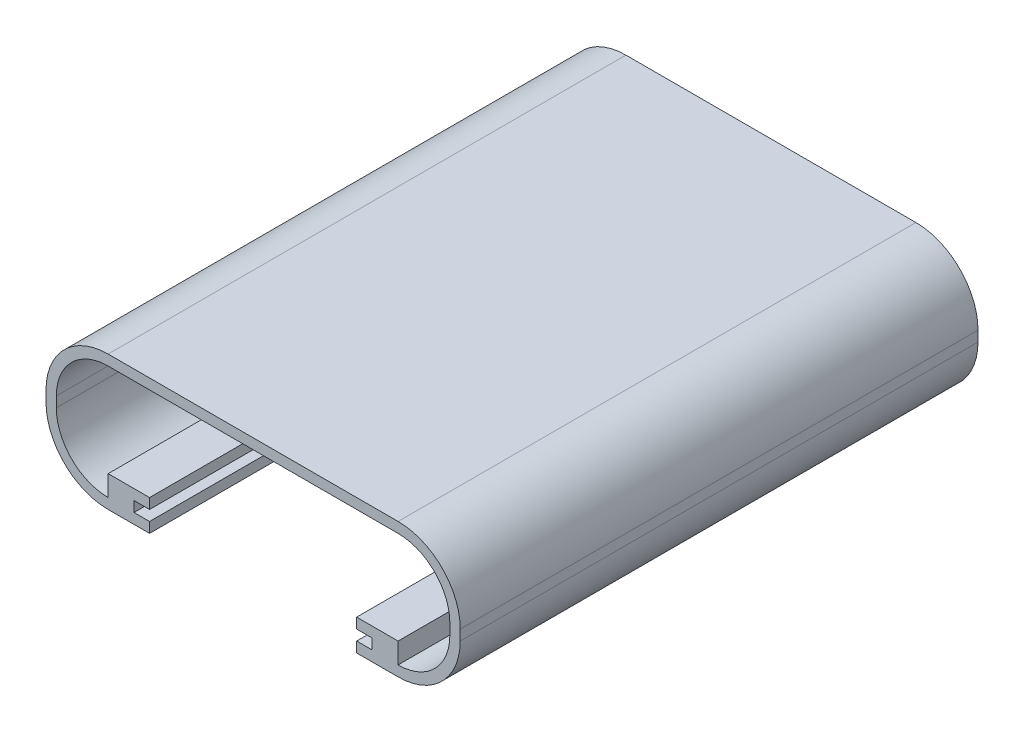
SolidWorks part; units mm, degrees
ref_plane "Plan de face" through (0, 0, 0) normal (0, 0, 1) x (1, 0, 0)
ref_plane "Plan de dessus" through (0, 0, 0) normal (0, 1, 0) x (1, 0, 0)
ref_plane "Plan de droite" through (0, 0, 0) normal (1, 0, 0) x (0, 0, -1)
sketch "Esquisse1" plane through (0, 0, 0) normal (0, 0, 1) x (1, 0, 0)
  line L0 (-21.316, 1) -> (-21.316, 0)
  line L1 (1.684, 0) -> (0.184, 0)
  line L2 (-19.816, 0) -> (-19.816, -1)
  line L3 (-28.816, 5) -> (-28.816, 6)
  line L4 (-21.316, 0) -> (-19.816, 0)
  line L5 (9.184, 5) -> (9.184, 6)
  line L6 (4.184, 0) -> (4.184, 2)
  line L7 (-23.816, 11) -> (4.184, 11)
  line L8 (4.184, 2) -> (0.184, 2)
  line L9 (0.184, 2) -> (0.184, 1)
  line L10 (0.184, 0) -> (0.184, -1)
  line L11 (0.184, -1) -> (4.184, -1)
  line L12 (-19.816, -1) -> (-23.816, -1)
  line L13 (10.184, 5) -> (10.184, 6)
  line L14 (-29.816, 5) -> (-29.816, 6)
  line L15 (0.184, 1) -> (1.684, 1)
  line L16 (-23.816, 12) -> (4.184, 12)
  line L17 (-23.816, 0) -> (-23.816, 2)
  line L18 (-23.816, 2) -> (-19.816, 2)
  line L19 (-19.816, 2) -> (-19.816, 1)
  line L20 (-19.816, 1) -> (-21.316, 1)
  line L21 (1.684, 1) -> (1.684, 0)
  arc A0 (-23.816, 0) -> (-28.816, 5) centre (-23.816, 5) cw
  arc A1 (4.184, 0) -> (9.184, 5) centre (4.184, 5) ccw
  arc A2 (-28.816, 6) -> (-23.816, 11) centre (-23.816, 6) cw
  arc A3 (9.184, 6) -> (4.184, 11) centre (4.184, 6) ccw
  arc A4 (4.184, -1) -> (10.184, 5) centre (4.184, 5) ccw
  arc A5 (-29.816, 6) -> (-23.816, 12) centre (-23.816, 6) cw
  arc A6 (-23.816, -1) -> (-29.816, 5) centre (-23.816, 5) cw
  arc A7 (10.184, 6) -> (4.184, 12) centre (4.184, 6) ccw
extrude "Boss.-Extru.1" add sketch "Esquisse1" along normal blind 50
